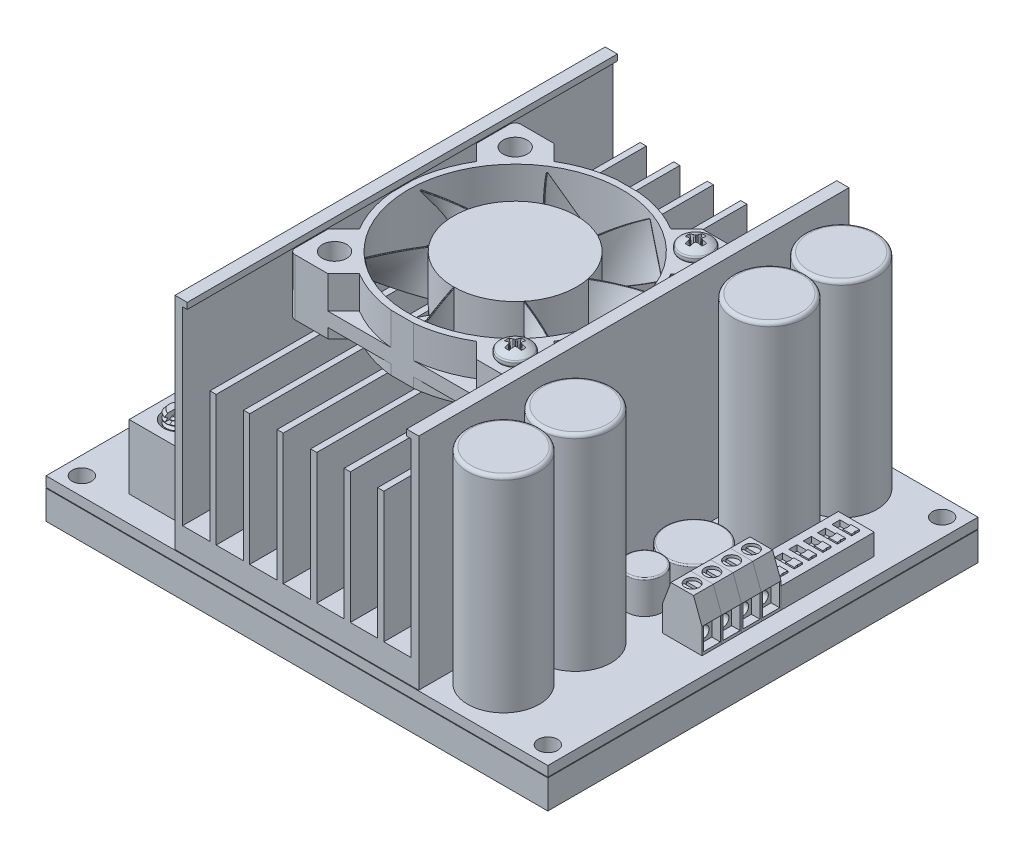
SolidWorks part; units mm, degrees
other "<User Library-40mm x 10mm fan>-<Fillet1>"
other "<User Library-40mm x 10mm fan>-<CirPattern1>"
other "<User Library-40mm x 10mm fan>-<Extrude6>"
other "<User Library-40mm x 10mm fan>-<Fillet3>"
other "<User Library-40mm x 10mm fan>-<CirPattern3[1]>"
other "<User Library-40mm x 10mm fan>-<CirPattern3[2]>"
other "<User Library-40mm x 10mm fan>-<CirPattern3[3]>"
other "<User Library-40mm x 10mm fan>-<CirPattern3[4]>"
other "<User Library-40mm x 10mm fan>-<CirPattern3[5]>"
other "<User Library-40mm x 10mm fan>-<CirPattern3[6]>"
other "<terminal block>-<컷-돌출4>"
other "<terminal block>-<선형 패턴1[1]>"
other "<terminal block>-<선형 패턴1[2]>"
other "<terminal block>-<선형 패턴1[3]>"
other "<DipSwitch>-<Boss-Extrude2>"
other "<DipSwitch>-<Boss-Extrude3>"
other "<DipSwitch>-<Boss-Extrude4>"
other "<DipSwitch>-<Boss-Extrude5>"
other "<DipSwitch>-<LPattern1[1]>"
other "<DipSwitch>-<LPattern1[2]>"
other "<DipSwitch>-<LPattern1[3]>"
other "<DipSwitch>-<LPattern1[4]>"
other "<DipSwitch>-<LPattern1[5]>"
other "<DipSwitch>-<LPattern1[6]>"
other "<DipSwitch>-<LPattern1[7]>"
other "<DipSwitch>-<LPattern1[8]>"
other "<DipSwitch>-<LPattern1[9]>"
other "<DipSwitch>-<LPattern1[10]>"
other "<DipSwitch>-<LPattern1[11]>"
other "<DipSwitch>-<LPattern2>"
other "<DipSwitch>-<LPattern3[1]>"
other "<DipSwitch>-<LPattern3[2]>"
other "<DipSwitch>-<LPattern3[3]>"
other "<DipSwitch>-<LPattern3[4]>"
other "<DipSwitch>-<LPattern3[5]>"
other "<DipSwitch>-<LPattern3[6]>"
other "<DipSwitch>-<LPattern3[7]>"
other "<DipSwitch>-<LPattern3[8]>"
other "<DipSwitch>-<LPattern3[9]>"
other "<DipSwitch>-<LPattern3[10]>"
other "<Big Lug>-<Cut-Extrude2>"
other "<90272A272_ZINC-PLTD STL PAN HEAD PHILLIPS MACHINE SCREW>-<Split Line1>"
other "<90272A272_ZINC-PLTD STL PAN HEAD PHILLIPS MACHINE SCREW>-<Split Line1>"
other "<Big Lug>-<<94025A150_18-8 SS SLOTTED CUP POINT SET SCREW>-<Cut-Extrude10>>"
other "<Big Lug>-<Cut-Extrude2>"
other "<Big Lug>-<<94025A150_18-8 SS SLOTTED CUP POINT SET SCREW>-<Cut-Extrude10>>"
other "<Small Lug>-<Cut-Extrude2>"
other "<Small Lug>-<<94025A502_18-8 SS SLOTTED CUP POINT SET SCREW>-<Cut-Extrude10>>"
other "<Small Lug>-<Cut-Extrude2>"
other "<Small Lug>-<<94025A502_18-8 SS SLOTTED CUP POINT SET SCREW>-<Cut-Extrude10>>"
other "<Small Lug>-<Cut-Extrude2>"
other "<Small Lug>-<<94025A502_18-8 SS SLOTTED CUP POINT SET SCREW>-<Cut-Extrude10>>"
other "<Small Lug>-<Cut-Extrude2>"
other "<Small Lug>-<<94025A502_18-8 SS SLOTTED CUP POINT SET SCREW>-<Cut-Extrude10>>"
ref_plane "Front" through (0, 0, 0) normal (0, 0, 1) x (1, 0, 0)
ref_plane "Top" through (0, 0, 0) normal (0, 1, 0) x (1, 0, 0)
ref_plane "Section" through (0, 0, 0) normal (1, 0, 0) x (0, 0, -1)
sketch "Sketch1" plane through (0, 0, 0) normal (0, 1, 0) x (1, 0, 0)
  line L1 (44.45, -38.1) -> (-44.45, -38.1)
  line L2 (44.45, -38.1) -> (44.45, 38.1)
  line L3 (44.45, 38.1) -> (-44.45, 38.1)
  line L4 (-44.45, -38.1) -> (-44.45, 38.1)
  line L5 (44.45, -38.1) -> (-44.45, 38.1) construction
  line L6 (44.45, 38.1) -> (-44.45, -38.1) construction
  point P0 (0, 0)
  dimension "D1" = 88.9
  dimension "D2" = 76.2
extrude "Aluminum Base" add sketch "Sketch1" along normal blind 5.08
sketch "Sketch2" plane through (0, 5.08, 0) normal (0, 1, 0) x (1, 0, 0)
  line L0 (44.45, 38.1) -> (-44.45, 38.1) construction
  line L1 (43.815, -37.465) -> (-43.815, -37.465)
  line L2 (43.815, -37.465) -> (43.815, 37.465)
  line L3 (43.815, 37.465) -> (-43.815, 37.465)
  line L4 (-43.815, -37.465) -> (-43.815, 37.465)
  line L5 (43.815, -37.465) -> (-43.815, 37.465) construction
  line L6 (43.815, 37.465) -> (-43.815, -37.465) construction
  line L7 (-44.45, 38.1) -> (-44.45, -38.1) construction
  point P0 (0, 0)
  dimension "D1" = 0.635
  dimension "D2" = 0.635
extrude "Dielectric Paste" add sketch "Sketch2" along normal blind 0.127
sketch "Sketch3" plane through (0, 5.207, 0) normal (0, 1, 0) x (1, 0, 0)
  line L1 (44.45, -38.1) -> (-44.45, -38.1)
  line L2 (44.45, -38.1) -> (44.45, 38.1)
  line L3 (44.45, 38.1) -> (-44.45, 38.1)
  line L4 (-44.45, -38.1) -> (-44.45, 38.1)
  line L5 (44.45, -38.1) -> (-44.45, 38.1) construction
  line L6 (44.45, 38.1) -> (-44.45, -38.1) construction
  point P0 (0, 0)
extrude "Cicuit Board" add sketch "Sketch3" along normal blind 1.778
sketch "Sketch11" plane through (0, 6.985, 0) normal (0, 1, 0) x (1, 0, 0)
  line L0 (-44.45, -38.1) -> (44.45, -38.1) construction
  line L1 (19.05, -37.465) -> (-19.05, -37.465)
  line L2 (19.05, -37.465) -> (19.05, 37.465)
  line L3 (19.05, 37.465) -> (-19.05, 37.465)
  line L4 (-19.05, -37.465) -> (-19.05, 37.465)
  line L5 (19.05, -37.465) -> (-19.05, 37.465) construction
  line L6 (19.05, 37.465) -> (-19.05, -37.465) construction
  point P0 (0, 0)
  dimension "D1" = 38.1
  dimension "D2" = 0.635
extrude "Dielectric Paste (2)" add sketch "Sketch11" along normal blind 0.127
sketch "Sketch4" plane through (0, 7.112, 0) normal (0, 1, 0) x (1, 0, 0)
  line L0 (44.45, 38.1) -> (-44.45, 38.1) construction
  line L1 (21.59, -38.1) -> (-21.59, -38.1)
  line L2 (21.59, -38.1) -> (21.59, 38.1)
  line L3 (21.59, 38.1) -> (-21.59, 38.1)
  line L4 (-21.59, -38.1) -> (-21.59, 38.1)
  line L5 (21.59, -38.1) -> (-21.59, 38.1) construction
  line L6 (21.59, 38.1) -> (-21.59, -38.1) construction
  point P0 (0, 0)
  dimension "D1" = 43.18
extrude "Heat Sink Body" add sketch "Sketch4" along normal blind 38.989
sketch "Sketch5" plane through (0, 0, 38.1) normal (0, 0, 1) x (1, 0, 0)
  line L0 (-19.431, 46.101) -> (-19.431, 45.0088)
  line L1 (-21.59, 46.101) -> (21.59, 46.101) construction
  line L2 (-19.431, 45.0088) -> (-20.2438, 45.0088)
  line L3 (-20.2438, 45.0088) -> (-20.2438, 11.43)
  line L4 (-20.2438, 11.43) -> (-15.396, 11.43)
  line L5 (-15.396, 11.43) -> (-15.396, 34.544)
  line L6 (-15.396, 34.544) -> (-14.3038, 34.544)
  line L7 (-14.3038, 34.544) -> (-14.3038, 11.43)
  line L8 (-14.3038, 11.43) -> (-9.4561, 11.43)
  line L9 (-9.4561, 11.43) -> (-9.4561, 34.544)
  line L10 (-9.4561, 34.544) -> (-8.3639, 34.544)
  line L11 (-8.3639, 34.544) -> (-8.3639, 11.43)
  line L12 (-8.3639, 11.43) -> (-3.5161, 11.43)
  line L13 (-3.5161, 11.43) -> (-3.5161, 34.544)
  line L14 (-3.5161, 34.544) -> (-2.4239, 34.544)
  line L15 (-2.4239, 34.544) -> (-2.4239, 11.43)
  line L16 (-2.4239, 11.43) -> (2.4239, 11.43)
  line L17 (2.4239, 11.43) -> (2.4239, 34.544)
  line L18 (2.4239, 34.544) -> (3.5161, 34.544)
  line L19 (3.5161, 34.544) -> (3.5161, 11.43)
  line L20 (3.5161, 11.43) -> (8.3639, 11.43)
  line L21 (8.3639, 11.43) -> (8.3639, 34.544)
  line L22 (8.3639, 34.544) -> (9.4561, 34.544)
  line L23 (9.4561, 34.544) -> (9.4561, 11.43)
  line L24 (9.4561, 11.43) -> (14.3038, 11.43)
  line L25 (14.3038, 11.43) -> (14.3038, 34.544)
  line L26 (14.3038, 34.544) -> (15.396, 34.544)
  line L27 (15.396, 34.544) -> (15.396, 11.43)
  line L28 (15.396, 11.43) -> (20.2438, 11.43)
  line L29 (20.2438, 11.43) -> (20.2438, 45.0088)
  line L30 (20.2438, 45.0088) -> (19.431, 45.0088)
  line L31 (19.431, 45.0088) -> (19.431, 46.101)
  line L32 (19.431, 46.101) -> (-19.431, 46.101)
  line L33 (-21.59, 46.101) -> (-21.59, 7.112) construction
  line L34 (21.59, 46.101) -> (21.59, 7.112) construction
  line L35 (-44.45, 6.985) -> (44.45, 6.985) construction
  point P36 (19.431, 45.5549)
  dimension "D1" = 1.0922
  dimension "D2" = 2.159
  dimension "D3" = 2.159
  dimension "D4" = 1.3462
  dimension "D5" = 1.3462
  dimension "D6" = 1.0922
  dimension "D14" = 23.114
  dimension "D15" = 4.445
extrude "Heat Sink Fin Cut" cut sketch "Sketch5" against normal through all
inserted part "User Library-40mm x 10mm fan"
move or copy body "Body-Move/Copy2" placed by mates yes
other "Distance1" parameters "D1"=17.78
inserted part "terminal block"
move or copy body "Body-Move/Copy4" placed by mates yes
other "Distance3" parameters "D1"=30.48
other "Distance4" parameters "D1"=3.175
inserted part "DipSwitch"
move or copy body "Body-Move/Copy6" placed by mates yes
sketch "Sketch6" plane through (0, 6.985, 0) normal (0, 1, 0) x (1, 0, 0)
  line L1 (44.45, 38.1) -> (-44.45, 38.1) construction
  line L2 (-44.45, -38.1) -> (44.45, -38.1) construction
  line L3 (21.59, -38.1) -> (21.59, 38.1) construction
  circle A0 centre (27.9654, 30.353) radius 6.35
  circle A1 centre (27.9654, 17.6276) radius 6.35
  circle A2 centre (27.9654, -16.7386) radius 6.35
  circle A3 centre (27.9654, -29.464) radius 6.35
  dimension "D2" = 2.286
  dimension "D3" = 12.7
  dimension "D4" = 0.0254
  dimension "D5" = 0.0254
  dimension "D1" = 1.397
  dimension "D6" = 0.0254
extrude "Capacitors" add sketch "Sketch6" along normal blind 36.322
fillet "Capacitor Top Fillet" radius 0.635 4 edges at (27.9654, 43.307, -24.003) (27.9654, 43.307, -11.2776) (27.9654, 43.307, 23.0886) (27.9654, 43.307, 35.814)
sketch "Sketch7" plane through (0, 6.985, 0) normal (0, 1, 0) x (1, 0, 0)
  line L0 (27.9325, 4.318) -> (21.59, 4.318) construction
  line L1 (21.59, -38.1) -> (21.59, 38.1) construction
  line L2 (27.9325, 4.318) -> (34.275, 4.318) construction
  line L3 (34.275, 2.88) -> (34.275, 6.38) construction
  line L4 (35.775, -7.62) -> (34.275, -7.62) construction
  circle A0 centre (27.9325, -4.445) radius 3.175
  circle A1 centre (27.9325, 4.318) radius 5.08 construction
  dimension "D1" = 6.35
  dimension "D2" = 10.16
  dimension "D3" = 0.508
extrude "Boss-Extrude7" add sketch "Sketch7" along normal blind 5.842
sketch "Sketch10" plane through (0, 6.985, 0) normal (0, 1, 0) x (1, 0, 0)
  line L0 (27.9325, 4.318) -> (21.59, 4.318) construction
  line L1 (27.9325, 4.318) -> (34.275, 4.318) construction
  circle A0 centre (27.9325, -4.445) radius 3.175 construction
  circle A1 centre (27.9325, 4.318) radius 5.08
  point P6 (27.9325, -4.445)
extrude "Boss-Extrude8" add sketch "Sketch10" along normal blind 4.826
fillet "Fillet2" radius 0.254 2 edges at (27.9325, 11.811, 0.762) (27.9325, 12.827, 7.62)
inserted part "Big Lug"
move or copy body "Body-Move/Copy8" placed by mates yes
other "Distance6" parameters "D1"=6.731
other "Distance7" parameters "D1"=26.162
inserted part "Big Lug1"
move or copy body "Body-Move/Copy10" placed by mates yes
other "Distance8" parameters "D1"=2.032
inserted part "Small Lug"
move or copy body "Body-Move/Copy12" placed by mates yes
other "Distance9" parameters "D1"=10.16
other "Distance10" parameters "D1"=2.032
inserted part "Small Lug1"
move or copy body "Body-Move/Copy14" placed by mates yes
other "Distance11" parameters "D1"=2.032
inserted part "Small Lug2"
move or copy body "Body-Move/Copy16" placed by mates yes
other "Distance12" parameters "D1"=2.032
inserted part "Small Lug3"
move or copy body "Body-Move/Copy18" placed by mates yes
other "Distance13" parameters "D1"=2.032
sketch "Sketch12" plane through (0, 6.985, 0) normal (0, 1, 0) x (1, 0, 0)
  line L1 (41.275, -34.925) -> (-41.275, -34.925) construction
  line L2 (41.275, -34.925) -> (41.275, 34.925) construction
  line L3 (41.275, 34.925) -> (-41.275, 34.925) construction
  line L4 (-41.275, -34.925) -> (-41.275, 34.925) construction
  line L5 (41.275, -34.925) -> (-41.275, 34.925) construction
  line L6 (41.275, 34.925) -> (-41.275, -34.925) construction
  circle A0 centre (-41.275, 34.925) radius 1.7145
  circle A1 centre (41.275, 34.925) radius 1.7145
  circle A2 centre (41.275, -34.925) radius 1.7145
  circle A3 centre (-41.275, -34.925) radius 1.7145
  point P0 (0, 0)
  dimension "D1" = 3.429
  dimension "D2" = 82.55
  dimension "D3" = 69.85
extrude "Mounting Holes" cut sketch "Sketch12" against normal through all
sketch "Sketch13" plane through (0, 41.304, 0) normal (0, 1, 0) x (1, 0, 0)
  line L0 (17.2434, -19.4509) -> (20.0093, -16.6998) construction
  line L1 (20.0093, -16.6998) -> (19.0097, -12.9289) construction
  line L2 (19.0097, -12.9289) -> (15.2442, -11.9091) construction
  line L3 (15.2442, -11.9091) -> (12.4783, -14.6602) construction
  line L4 (12.4783, -14.6602) -> (13.4779, -18.4311) construction
  line L5 (13.4779, -18.4311) -> (17.2434, -19.4509) construction
  line L6 (20.0093, 17.3398) -> (17.2434, 20.0909) construction
  line L7 (17.2434, 20.0909) -> (13.4779, 19.0711) construction
  line L8 (13.4779, 19.0711) -> (12.4783, 15.3002) construction
  line L9 (12.4783, 15.3002) -> (15.2442, 12.5491) construction
  line L10 (15.2442, 12.5491) -> (19.0097, 13.5689) construction
  line L11 (19.0097, 13.5689) -> (20.0093, 17.3398) construction
  line L12 (-16.7558, 20.0909) -> (-19.5217, 17.3398) construction
  line L13 (-19.5217, 17.3398) -> (-18.5221, 13.5689) construction
  line L14 (-18.5221, 13.5689) -> (-14.7566, 12.5491) construction
  line L15 (-14.7566, 12.5491) -> (-11.9907, 15.3002) construction
  line L16 (-11.9907, 15.3002) -> (-12.9903, 19.0711) construction
  line L17 (-12.9903, 19.0711) -> (-16.7558, 20.0909) construction
  line L18 (-19.5217, -16.6998) -> (-16.7558, -19.4509) construction
  line L19 (-16.7558, -19.4509) -> (-12.9903, -18.4311) construction
  line L20 (-12.9903, -18.4311) -> (-11.9907, -14.6602) construction
  line L21 (-11.9907, -14.6602) -> (-14.7566, -11.9091) construction
  line L22 (-14.7566, -11.9091) -> (-18.5221, -12.9289) construction
  line L23 (-18.5221, -12.9289) -> (-19.5217, -16.6998) construction
  line L24 (17.2434, -19.4509) -> (20.0093, -16.6998)
  line L25 (20.0093, -16.6998) -> (19.0097, -12.9289)
  line L26 (19.0097, -12.9289) -> (15.2442, -11.9091)
  line L27 (15.2442, -11.9091) -> (12.4783, -14.6602)
  line L28 (12.4783, -14.6602) -> (13.4779, -18.4311)
  line L29 (13.4779, -18.4311) -> (17.2434, -19.4509)
  line L30 (20.0093, 17.3398) -> (17.2434, 20.0909)
  line L31 (17.2434, 20.0909) -> (13.4779, 19.0711)
  line L32 (13.4779, 19.0711) -> (12.4783, 15.3002)
  line L33 (12.4783, 15.3002) -> (15.2442, 12.5491)
  line L34 (15.2442, 12.5491) -> (19.0097, 13.5689)
  line L35 (19.0097, 13.5689) -> (20.0093, 17.3398)
  line L36 (-16.7558, 20.0909) -> (-19.5217, 17.3398)
  line L37 (-19.5217, 17.3398) -> (-18.5221, 13.5689)
  line L38 (-18.5221, 13.5689) -> (-14.7566, 12.5491)
  line L39 (-14.7566, 12.5491) -> (-11.9907, 15.3002)
  line L40 (-11.9907, 15.3002) -> (-12.9903, 19.0711)
  line L41 (-12.9903, 19.0711) -> (-16.7558, 20.0909)
  line L42 (-19.5217, -16.6998) -> (-16.7558, -19.4509)
  line L43 (-16.7558, -19.4509) -> (-12.9903, -18.4311)
  line L44 (-12.9903, -18.4311) -> (-11.9907, -14.6602)
  line L45 (-11.9907, -14.6602) -> (-14.7566, -11.9091)
  line L46 (-14.7566, -11.9091) -> (-18.5221, -12.9289)
  line L47 (-18.5221, -12.9289) -> (-19.5217, -16.6998)
  circle A0 centre (-15.7562, -15.68) radius 2.15 construction
  circle A1 centre (-15.7562, 16.32) radius 2.15 construction
  circle A2 centre (16.2438, 16.32) radius 2.15 construction
  circle A3 centre (16.2438, -15.68) radius 2.15 construction
  circle A4 centre (16.2438, -15.68) radius 2.15
  circle A5 centre (16.2438, 16.32) radius 2.15
  circle A6 centre (-15.7562, 16.32) radius 2.15
  circle A7 centre (-15.7562, -15.68) radius 2.15
extrude "Boss-Extrude10" add sketch "Sketch13" along normal up to surface (3.24 mm away)
inserted part "Pan Head Screw"
move or copy body "Body-Move/Copy20" placed by mates yes
inserted part "Pan Head Screw (2)"
move or copy body "Body-Move/Copy22" placed by mates yes
